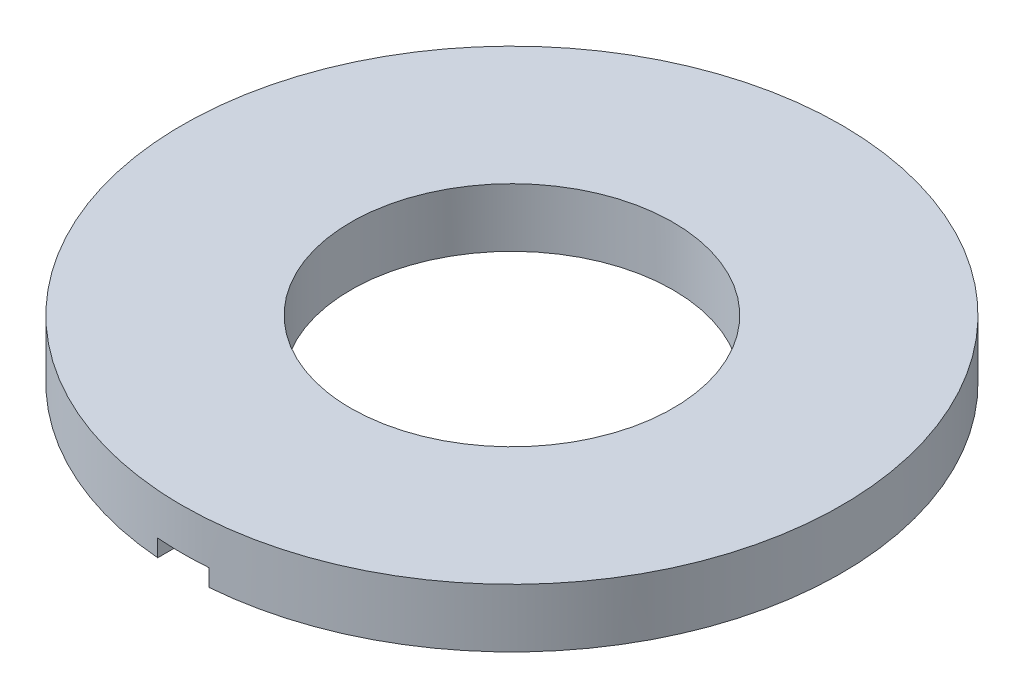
SolidWorks part; units mm, degrees
ref_plane "Front Plane" through (0, 0, 0) normal (0, 0, 1) x (1, 0, 0)
ref_plane "Top Plane" through (0, 0, 0) normal (0, 1, 0) x (1, 0, 0)
ref_plane "Right Plane" through (0, 0, 0) normal (1, 0, 0) x (0, 0, -1)
sketch "Sketch1" plane through (0, 0, 0) normal (0, 1, 0) x (1, 0, 0)
  circle A0 centre (0, 0) radius 2.2
  circle A1 centre (0, 0) radius 4.5
  dimension "D1" = 4.4
  dimension "D2" = 9
extrude "Extrude1" add sketch "Sketch1" along normal blind 0.8
sketch "Sketch2" plane through (0, 0, 0) normal (0, -1, 0) x (1, 0, 0)
  line L1 (-0.35, -0.1) -> (0.35, -0.1)
  line L2 (-0.35, -0.1) -> (-0.35, 4.5)
  line L3 (-0.35, 4.5) -> (0.35, 4.5)
  line L4 (0.35, -0.1) -> (0.35, 4.5)
  line L5 (-0.35, -0.1) -> (0.35, 4.5) construction
  line L6 (-0.35, 4.5) -> (0.35, -0.1) construction
  circle A0 centre (0, 0) radius 2.2 construction
  circle A1 centre (0, 0) radius 4.5 construction
  point P0 (0, 2.2)
  dimension "D1" = 0.7
extrude "Cut-Extrude1" cut sketch "Sketch2" against normal blind 0.2333
